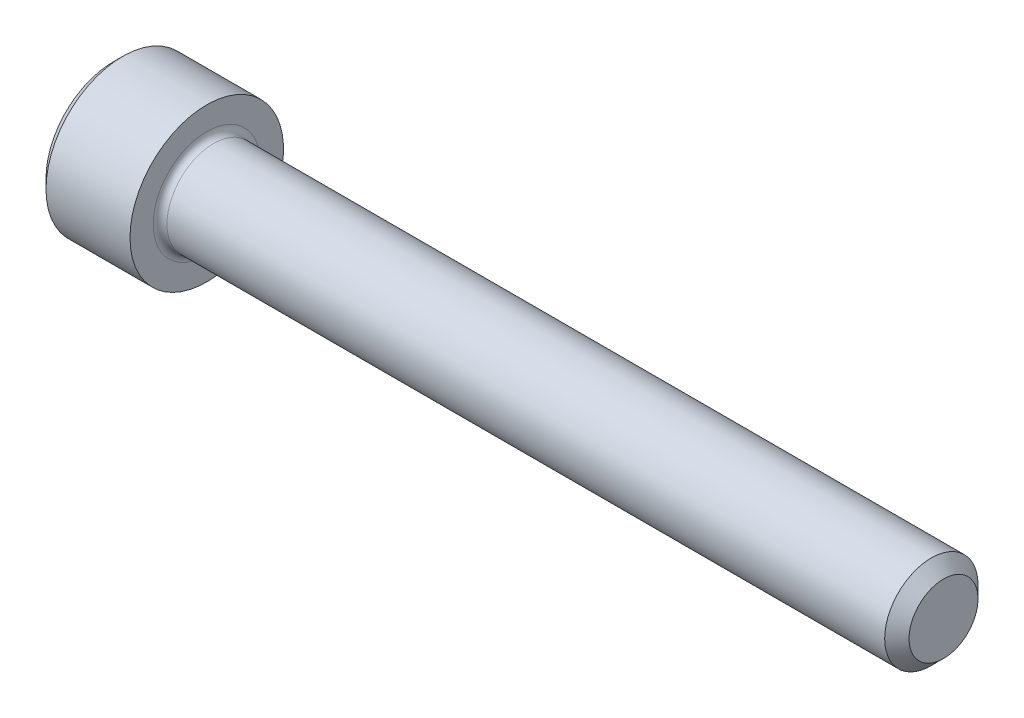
SolidWorks part; units mm, degrees
revolve "Base-Revolve" add sketch "BodySke"
sketch "BodySke" plane through (0, 0, 0) normal (0, 0, 1) x (1, 0, 0)
  line L0 (0, 0) -> (0, 3.4861)
  line L1 (0.4826, 3.9688) -> (4.826, 3.9688)
  line L2 (4.826, 3.9688) -> (4.826, 2.413)
  line L3 (4.826, 2.413) -> (42.2961, 2.413)
  line L4 (42.926, 1.7831) -> (42.926, 0)
  line L5 (42.926, 0) -> (0, 0)
  line L6 (-31.75, 0) -> (127, 0) construction
  line L7 (0, 3.4861) -> (0.4826, 3.9688)
  line L8 (42.926, 1.7831) -> (42.2961, 2.413)
  line L9 (0, -3.4861) -> (0.4826, -3.9688) construction
  line L10 (42.926, -1.7831) -> (42.2961, -2.413) construction
  line L11 (5.8852, 9.525) -> (5.8852, 3.175) construction
  line L12 (14.351, 9.525) -> (14.351, 3.175) construction
  line L13 (4.826, 9.525) -> (4.826, 3.175) construction
  dimension "Diameter" = 4.826
  dimension "Head_ht" = 4.826
  dimension "Length" = 38.1
  dimension "Body_ch_ang" = 45
  dimension "Head_dia" = 7.9375
  dimension "Head_ch_ang" = 45
  dimension "Head_side_ht" = 4.3434
  dimension "Minor_dia" = 3.5662
  dimension "Advance" = 1.0592
  dimension "Thread_nom" = 28.575
  dimension "Thread_length" = 38.1
fillet "Fillet1" radius 0.3556 1 edges at (4.826, 0, 2.413)
ref_plane "Plane1" through (0, 0, 0) normal (0, 0, 1) x (1, 0, 0)
ref_plane "Plane2" through (0, 0, 0) normal (0, 1, 0) x (1, 0, 0)
ref_plane "Plane3" through (0, 0, 0) normal (1, 0, 0) x (0, 0, -1)
sketch "Sketch2" plane through (0, 0, 0) normal (0, 0, 1) x (1, 0, 0)
  line L0 (0, 1.985) -> (2.286, 1.985)
  line L1 (2.286, 1.985) -> (3.432, 0)
  line L2 (-31.75, 0) -> (127, 0) construction
  line L3 (3.432, 0) -> (0, 0)
  line L4 (0, 0) -> (0, 1.985)
  line L5 (0, 3.4861) -> (0, -3.4861) construction
  line L6 (0, 0) -> (47.625, 0) construction
  line L7 (4.826, -3.9688) -> (4.826, 3.9688) construction
revolve "Hex-PreBroach" cut sketch "Sketch2" angle 360 about L6
sketch "Sketch3" plane through (0, 0, 0) normal (-1, 0, 0) x (0, 0.5, 0.866)
  line L0 (1.146, 1.985) -> (-1.146, 1.985)
  line L1 (-1.146, 1.985) -> (-2.2921, 0)
  line L2 (1.146, 1.985) -> (2.2921, 0)
  line L3 (1.146, -1.985) -> (2.2921, 0)
  line L4 (1.146, -1.985) -> (-1.146, -1.985)
  line L5 (-1.146, -1.985) -> (-2.2921, 0)
extrude "Hex" cut sketch "Sketch3" against normal blind 2.286
sketch "Sketch4" plane through (0, 0, 0) normal (-1, 0, 0) x (0, 0, 1)
  line L0 (0, 0) -> (2.3876, 0)
  line L1 (0, 0) -> (6.1484, 3.5498) construction
  line L2 (0, 0) -> (1.1938, 2.0677)
  line L3 (1.9883, 0.576) -> (2.2704, 0.7389)
  line L4 (1.493, 1.4339) -> (1.7751, 1.5968)
  arc A0 (1.9883, 0.576) -> (1.493, 1.4339) centre (0, 0) ccw
  arc A1 (2.3876, 0) -> (2.2704, 0.7389) centre (0, 0) ccw
  arc A2 (1.1938, 2.0677) -> (1.7751, 1.5968) centre (0, 0) cw
extrude "Spline" [suppressed] cut sketch "Sketch4" against normal blind 2.286
pattern_circular "CirPattern1" [suppressed] count 6 every 60
sketch "Sketch5" plane through (0, 0, 0) normal (0, 0, 1) x (1, 0, 0)
  line L0 (-31.75, 0) -> (127, 0) construction
  line L2 (0, 3.4861) -> (0, -3.4861) construction
  circle A0 centre (1.651, 0) radius 0.5906
  dimension "Drilled_hole_dia" = 1.1811
  dimension "Drilled_hole_loc" = 1.651
extrude "Hole" [suppressed] cut sketch "Sketch5" against normal through all and the other way through all
pattern_circular "Drilled-4" [suppressed] count 2 every 60
pattern_circular "Drilled-6" [suppressed] count 3 every 60
sketch "ThdSchSke" plane through (0, 0, 0) normal (0, 0, 1) x (1, 0, 0)
  line L0 (14.351, -1.7831) -> (13.9099, -2.413)
  line L1 (14.351, -1.7831) -> (14.7921, -2.413)
  line L2 (14.7921, -2.413) -> (14.7921, -3.0162)
  line L3 (-3.175, 0) -> (5.1513, 0) construction
  line L5 (14.7921, -3.0162) -> (13.9099, -3.0162)
  line L6 (13.9099, -3.0162) -> (13.9099, -2.413)
  line L7 (0, 3.4861) -> (0, -3.4861) construction
revolve "ThreadSchematic" [suppressed] cut sketch "ThdSchSke" angle 360 about L3
pattern_linear "ThdSchPat" [suppressed]
equation "\"D2@Sketch3\" = \"Hex_size@Sketch3\" / 2"
equation "\"D1@Sketch3\" = \"Hex_size@Sketch3\" / 2"
equation "\"D1@Sketch2\" = \"Hex_size@Sketch3\" / 2"
equation "\"D3@Sketch4\" = \"Spline_p_dim@Sketch4\" / 2"
equation "\"Thread_minor@ThreadCosmetic\"  =  \"Minor_dia@BodySke\""
equation "\"D2@CirPattern1\" = 360 / \"Num_teeth@CirPattern1\""
equation "\"Wall_thickness@Sketch2\" = \"Head_ht@BodySke\" - \"Key_eng@Hex\""
equation "\"Thread_length@ThreadCosmetic\" = ((sgn( (\"Length@BodySke\" - \"Advance@BodySke\" ) - \"Thread_nom@BodySke\" )-1)*( (\"Length@BodySke\" - \"Advance@BodySke\" ) - \"Thread_nom@BodySke\" ))/-2+ \"Thread_nom@BodySke\""
equation "\"Thread_minor@ThdSchSke\" = \"Minor_dia@BodySke\""
equation "\"Diameter@ThdSchSke\" = \"Diameter@BodySke\""
equation "\"Overcut@ThdSchSke\" = \"Diameter@BodySke\" * 1.25"
equation "\"Start@ThdSchSke\" = \"Head_ht@BodySke\" + \"Length@BodySke\" - \"Thread_length@ThreadCosmetic\"  '---Non-countersunk---"
equation "\"Num_threads@ThdSchPat\" = int( \"Thread_length@ThreadCosmetic\" / \"Advance@BodySke\" + 0.999 )  + 1"
equation "\"Advance@ThdSchPat\" = \"Thread_length@ThreadCosmetic\" /  (\"Num_threads@ThdSchPat\" - 1) 'relax it"
equation "\"Num_threads@ThdSchPat\" = \"Num_threads@ThdSchPat\" - sgn( \"Num_threads@ThdSchPat\" - 1) '---chamfered tips only---"
